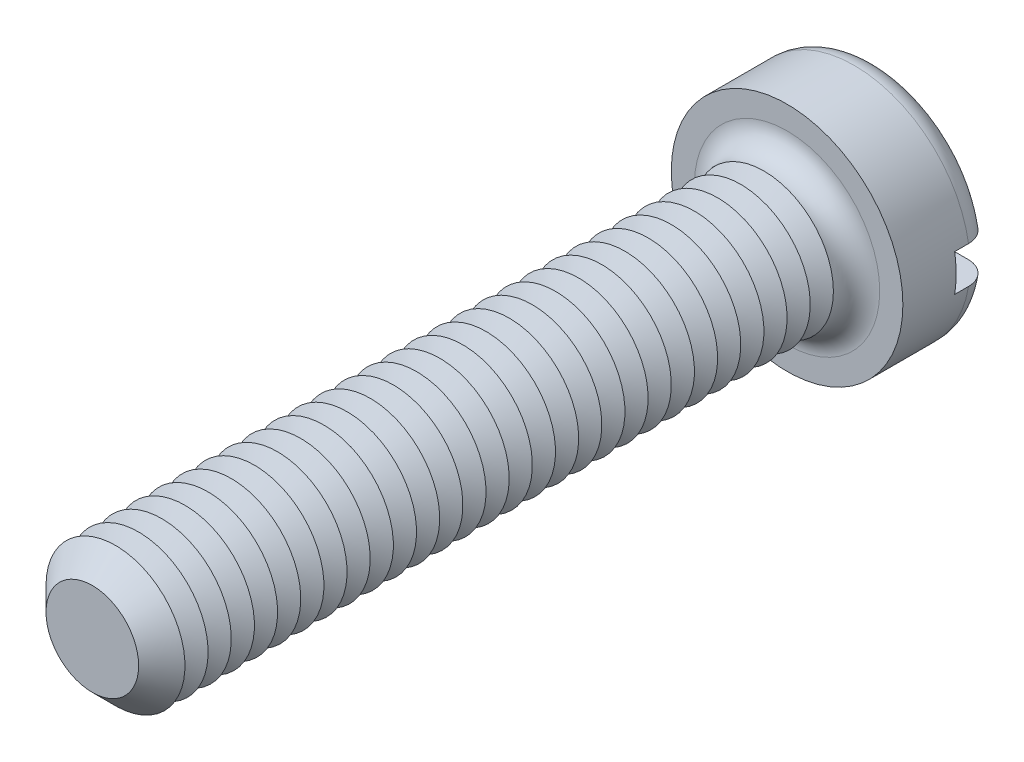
SolidWorks part; units mm, degrees
ref_plane "Front Plane" through (0, 0, 0) normal (0, 0, 1) x (1, 0, 0)
ref_plane "Top Plane" through (0, 0, 0) normal (0, 1, 0) x (1, 0, 0)
ref_plane "Right Plane" through (0, 0, 0) normal (1, 0, 0) x (0, 0, -1)
sketch "Sketch3" plane through (0, 0, 0) normal (0, 0, 1) x (1, 0, 0)
  circle A0 centre (0, 0) radius 5
  dimension "D1" = 10
extrude "Boss-Extrude2" add sketch "Sketch3" against normal blind 3.9
sketch "Sketch4" plane through (0, 0, 0) normal (0, 0, 1) x (1, 0, 0)
  circle A0 centre (0, 0) radius 3
  dimension "D1" = 6
extrude "Boss-Extrude3" add sketch "Sketch4" along normal blind 30
fillet "Fillet1" radius 1 2 edges at (5, 0, -3.9) (3, 0, 0)
chamfer "Chamfer1" distance 1 angle 45 1 edges at (3, 0, 30)
sketch "Sketch5" plane through (0, 0, 0) normal (1, 0, 0) x (0, 0, -1)
  line L0 (1.6944, 0) -> (-7.6738, 0) construction
sketch "Sketch6" plane through (0, 0, 0) normal (1, 0, 0) x (0, 0, -1)
  line L0 (-1, 3) -> (-1.5, 2.134)
  line L1 (-1.5, 2.134) -> (-2, 3)
  line L2 (-1, 3) -> (-29, 3) construction
  line L3 (-2, 3) -> (-1, 3)
  dimension "D1" = 1
revolve "Cut-Revolve1" cut sketch "Sketch6" angle 360 about L0
pattern_linear "LPattern1" count 28 spacing 1 along (0, 0, 1) of "Cut-Revolve1"
sketch "Sketch8" plane through (0, 0, -3.9) normal (0, 0, -1) x (-1, 0, 0)
  line L1 (5, -0.8) -> (-5, -0.8)
  line L2 (5, -0.8) -> (5, 0.8)
  line L3 (5, 0.8) -> (-5, 0.8)
  line L4 (-5, -0.8) -> (-5, 0.8)
  line L5 (5, -0.8) -> (-5, 0.8) construction
  line L6 (5, 0.8) -> (-5, -0.8) construction
  point P0 (0, 0)
  dimension "D1" = 10
  dimension "D2" = 1.6
extrude "Cut-Extrude1" cut sketch "Sketch8" against normal blind 1.6
